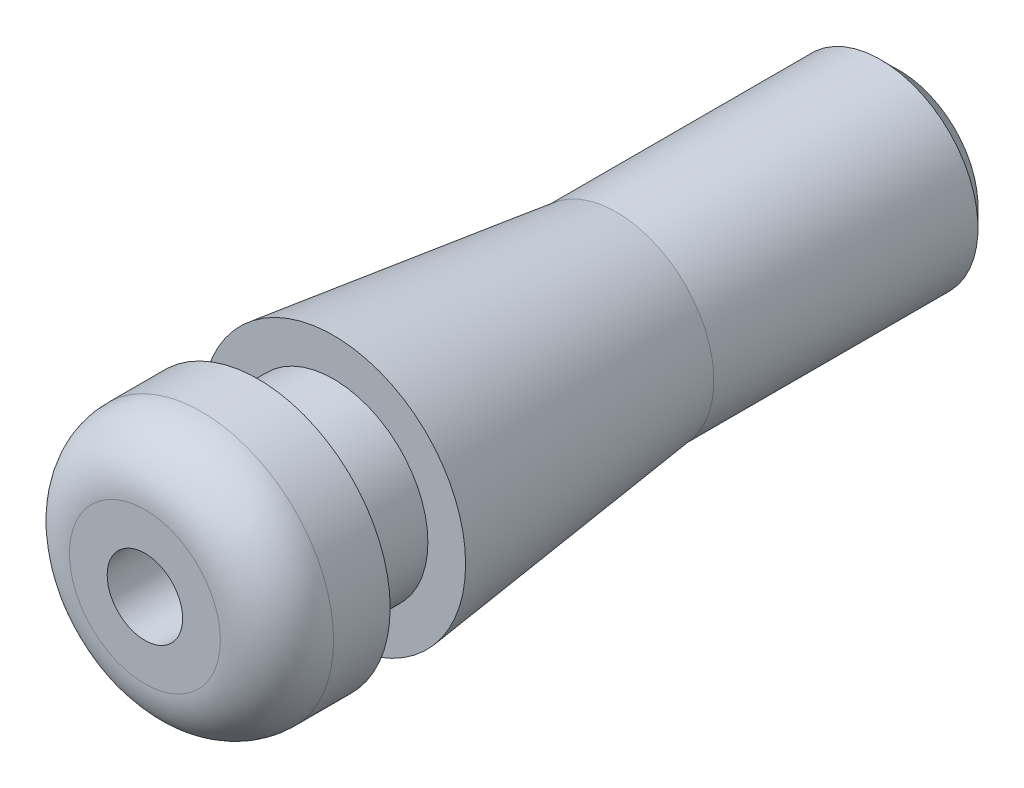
SolidWorks part; units mm, degrees
ref_plane "Plan1" through (0, 0, 0) normal (0, 0, 1) x (1, 0, 0)
ref_plane "Plan2" through (0, 0, 0) normal (0, 1, 0) x (1, 0, 0)
ref_plane "Plan3" through (0, 0, 0) normal (1, 0, 0) x (0, 0, -1)
sketch "Esquisse1" plane through (0, 0, 0) normal (0, 0, 1) x (1, 0, 0)
  circle A0 centre (0, 0) radius 5
  dimension "D1" = 10
extrude "Base-Extrusion" add sketch "Esquisse1" along normal blind 4
sketch "Esquisse2" plane through (0, 0, 4) normal (0, 0, 1) x (1, 0, 0)
  circle A0 centre (0, 0) radius 7
  dimension "D1" = 14
extrude "Boss.-Extru.1" add sketch "Esquisse2" along normal blind 6
fillet "Congé1" radius 3
sketch "Esquisse3" plane through (0, 0, 0) normal (0, 0, -1) x (-1, 0, 0)
  circle A0 centre (0, 0) radius 7
extrude "Boss.-Extru.2" add sketch "Esquisse3" along normal blind 15 draft 7
sketch "Esquisse4" plane through (0, 0, -15) normal (0, 0, -1) x (-1, 0, 0)
  circle A0 centre (0, 0) radius 5.1582
  circle A1 centre (0, 0) radius 5.1582 construction
extrude "Boss.-Extru.3" add sketch "Esquisse4" along normal blind 15
sketch "Esquisse5" plane through (0, 0, -30) normal (0, 0, -1) x (-1, 0, 0)
  circle A0 centre (0, 0) radius 2
  dimension "D1" = 4
extrude "Enlèv. mat.-Extru.1" cut sketch "Esquisse5" against normal through all
chamfer "Chanfrein1" distance 1 angle 45
